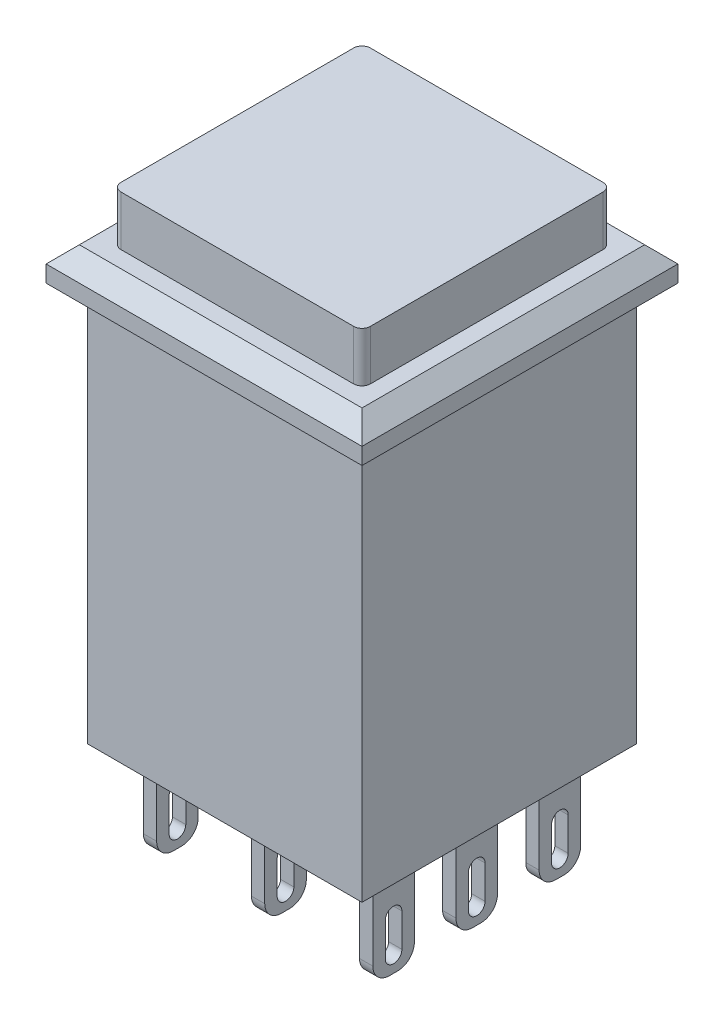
SolidWorks part; units mm, degrees
ref_plane "Front" through (0, 0, 0) normal (0, 0, 1) x (1, 0, 0)
ref_plane "Top" through (0, 0, 0) normal (0, 1, 0) x (1, 0, 0)
ref_plane "Right" through (0, 0, 0) normal (1, 0, 0) x (0, 0, -1)
sketch "Эскиз1" plane through (0, 0, 0) normal (0, 1, 0) x (1, 0, 0)
  line L1 (-9.5, -9.5) -> (9.5, -9.5)
  line L2 (-9.5, -9.5) -> (-9.5, 9.5)
  line L3 (-9.5, 9.5) -> (9.5, 9.5)
  line L4 (9.5, -9.5) -> (9.5, 9.5)
  line L5 (-9.5, -9.5) -> (9.5, 9.5) construction
  line L6 (-9.5, 9.5) -> (9.5, -9.5) construction
  point P0 (0, 0)
  dimension "D1" = 19
extrude "Вытянуть1" add sketch "Эскиз1" along normal blind 2
sketch "Эскиз2" plane through (0, 0, 0) normal (0, 1, 0) x (1, 0, 0)
  line L1 (-8.25, -8.25) -> (8.25, -8.25)
  line L2 (-8.25, -8.25) -> (-8.25, 8.25)
  line L3 (-8.25, 8.25) -> (8.25, 8.25)
  line L4 (8.25, -8.25) -> (8.25, 8.25)
  line L5 (-8.25, -8.25) -> (8.25, 8.25) construction
  line L6 (-8.25, 8.25) -> (8.25, -8.25) construction
  point P0 (0, 0)
  dimension "D1" = 16.5
extrude "Вытянуть2" add sketch "Эскиз2" against normal blind 24
sketch "Эскиз3" plane through (0, 2, 0) normal (0, 1, 0) x (1, 0, 0)
  line L1 (-7, -7.5) -> (7, -7.5)
  line L2 (-7.5, -7) -> (-7.5, 7)
  line L3 (-7, 7.5) -> (7, 7.5)
  line L4 (7.5, -7) -> (7.5, 7)
  line L5 (-7.5, -7.5) -> (7.5, 7.5) construction
  line L6 (-7.5, 7.5) -> (7.5, -7.5) construction
  arc A0 (-7.5, 7) -> (-7, 7.5) centre (-7, 7) cw
  arc A1 (-7, -7.5) -> (-7.5, -7) centre (-7, -7) cw
  arc A2 (7, -7.5) -> (7.5, -7) centre (7, -7) ccw
  arc A3 (7, 7.5) -> (7.5, 7) centre (7, 7) cw
  point P0 (0, 0)
  dimension "D2" = 0.5
  dimension "D1" = 15
extrude "Вытянуть3" add sketch "Эскиз3" along normal blind 3
sketch "Эскиз4" plane through (0, -24, 0) normal (0, -1, 0) x (1, 0, 0)
  line L0 (6.1, 6.25) -> (6.9, 6.25)
  line L1 (-6.9, 6.25) -> (-6.1, 6.25)
  line L2 (-6.9, 6.25) -> (-6.9, 3.75)
  line L3 (-6.9, 3.75) -> (-6.1, 3.75)
  line L4 (-6.1, 6.25) -> (-6.1, 3.75)
  line L5 (6.1, 6.25) -> (6.1, 3.75)
  line L6 (6.1, 3.75) -> (6.9, 3.75)
  line L7 (6.9, 6.25) -> (6.9, 3.75)
  line L8 (-6.9, 1.25) -> (-6.1, 1.25)
  line L9 (-6.9, 1.25) -> (-6.9, -1.25)
  line L10 (-6.9, -1.25) -> (-6.1, -1.25)
  line L11 (-6.1, 1.25) -> (-6.1, -1.25)
  line L12 (6.1, 1.25) -> (6.9, 1.25)
  line L13 (6.1, 1.25) -> (6.1, -1.25)
  line L14 (6.1, -1.25) -> (6.9, -1.25)
  line L15 (6.9, 1.25) -> (6.9, -1.25)
  line L16 (-6.9, -3.75) -> (-6.1, -3.75)
  line L17 (-6.9, -3.75) -> (-6.9, -6.25)
  line L18 (-6.9, -6.25) -> (-6.1, -6.25)
  line L19 (-6.1, -3.75) -> (-6.1, -6.25)
  line L20 (6.1, -3.75) -> (6.9, -3.75)
  line L21 (6.1, -3.75) -> (6.1, -6.25)
  line L22 (6.1, -6.25) -> (6.9, -6.25)
  line L23 (6.9, -3.75) -> (6.9, -6.25)
  line L24 (-6.1, 0) -> (6.1, 0) construction
  line L25 (0, 3.75) -> (0, -3.75) construction
  line L26 (-0.4, 6.25) -> (0.4, 6.25)
  line L27 (-0.4, 6.25) -> (-0.4, 3.75)
  line L28 (-0.4, 3.75) -> (0.4, 3.75)
  line L29 (0.4, 6.25) -> (0.4, 3.75)
  line L30 (-0.4, -3.75) -> (0.4, -3.75)
  line L31 (-0.4, -3.75) -> (-0.4, -6.25)
  line L32 (-0.4, -6.25) -> (0.4, -6.25)
  line L33 (0.4, -3.75) -> (0.4, -6.25)
  dimension "D1" = 0.8
  dimension "D2" = 2.5
  dimension "D3" = 5
  dimension "D4" = 13
extrude "Вытянуть4" add sketch "Эскиз4" along normal blind 6
sketch "Эскиз5" plane through (0, 0, 0) normal (1, 0, 0) x (0, 0, -1)
  line L0 (-5, -27) -> (-5, -29) construction
  line L1 (-4.5, -27) -> (-4.5, -29)
  line L2 (-5.5, -27) -> (-5.5, -29)
  line L3 (0, -27) -> (0, -29) construction
  line L4 (0.5, -27) -> (0.5, -29)
  line L5 (-0.5, -27) -> (-0.5, -29)
  line L6 (5, -27) -> (5, -29) construction
  line L7 (5.5, -27) -> (5.5, -29)
  line L8 (4.5, -27) -> (4.5, -29)
  line L9 (-5, -29) -> (-5, -30) construction
  line L10 (-3.75, -30) -> (-6.25, -30) construction
  arc A0 (-4.5, -27) -> (-5.5, -27) centre (-5, -27) ccw
  arc A1 (-5.5, -29) -> (-4.5, -29) centre (-5, -29) ccw
  arc A2 (0.5, -27) -> (-0.5, -27) centre (0, -27) ccw
  arc A3 (-0.5, -29) -> (0.5, -29) centre (0, -29) ccw
  arc A4 (5.5, -27) -> (4.5, -27) centre (5, -27) ccw
  arc A5 (4.5, -29) -> (5.5, -29) centre (5, -29) ccw
  point P2 (-5, -28)
  point P10 (0, -28)
  point P17 (5, -28)
  dimension "D1" = 5
  dimension "D2" = 1
  dimension "D3" = 2
  dimension "D4" = 1
extrude "Вытянуть5" cut sketch "Эскиз5" against normal through all and the other way through all
chamfer "Фаска1" distance 1 angle 45
fillet "Скругление1" radius 1
sketch "Эскиз6"
  dimension "D1" = 0.5
  dimension "D2" = 2
  dimension "D3" = 5
  dimension "D4" = 6.5
extrude "Txt" add sketch "Эскиз6" along normal blind 0.1
